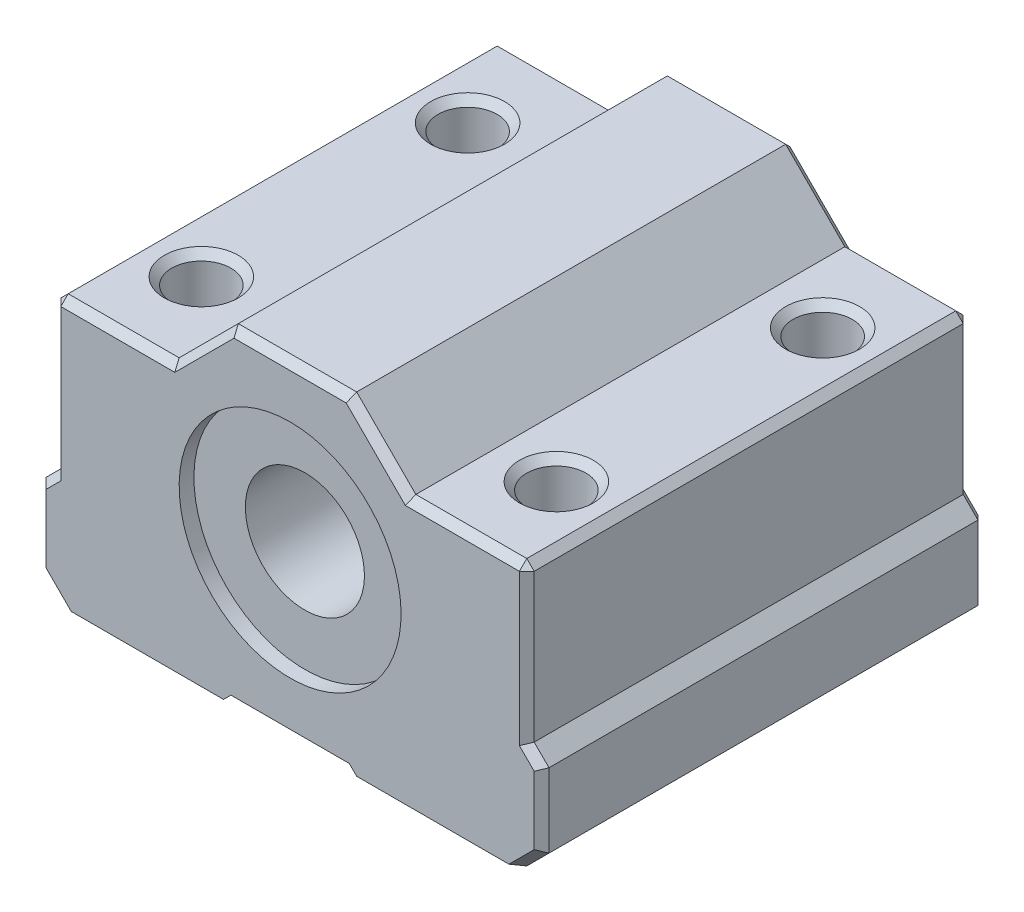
SolidWorks part; units mm, degrees
ref_plane "Ebene vorne" through (0, 0, 0) normal (0, 0, 1) x (1, 0, 0)
ref_plane "Ebene oben" through (0, 0, 0) normal (0, 1, 0) x (1, 0, 0)
ref_plane "Ebene rechts" through (0, 0, 0) normal (1, 0, 0) x (0, 0, -1)
ref_plane "Ebene1" through (0, 13.3186, 0) normal (0, 1, 0) x (1, 0, 0)
sketch "Skizze1" plane through (0, 13.3186, 0) normal (0, 1, 0) x (1, 0, 0)
  line L0 (17.0936, 0) -> (-16.9064, 0)
  line L1 (-16.9064, 0) -> (-16.9064, -30)
  line L2 (-16.9064, -30) -> (17.0936, -30)
  line L3 (17.0936, -30) -> (17.0936, 0)
extrude "Aufsatz-Linear austragen1" add sketch "Skizze1" against normal blind 22
sketch "Skizze2" plane through (0, 0, 0) normal (0, 0, -1) x (-1, 0, 0)
  line L0 (-17.0936, -1.1814) -> (-16.0936, -1.1814)
  line L1 (-16.0936, -1.1814) -> (-16.0936, 13.3186)
  line L2 (-16.0936, 13.3186) -> (-17.0936, 13.3186)
  line L3 (-17.0936, 13.3186) -> (-17.0936, -1.1814)
extrude "Schnitt-Linear austragen1" cut sketch "Skizze2" against normal through all
sketch "Skizze3" plane through (0, 0, 0) normal (0, 0, -1) x (-1, 0, 0)
  line L0 (-4.0936, 9.3186) -> (-4.0936, 13.3186)
  line L1 (-4.0936, 13.3186) -> (-16.0936, 13.3186)
  line L2 (-16.0936, 13.3186) -> (-16.0936, 9.3186)
  line L3 (-16.0936, 9.3186) -> (-4.0936, 9.3186)
extrude "Schnitt-Linear austragen2" cut sketch "Skizze3" against normal through all
sketch "Skizze4" plane through (0, 0, 0) normal (0, 0, -1) x (-1, 0, 0)
  line L0 (3.9064, 9.3186) -> (16.9064, 9.3186)
  line L1 (16.9064, 9.3186) -> (16.9064, 13.3186)
  line L2 (16.9064, 13.3186) -> (3.9064, 13.3186)
  line L3 (3.9064, 13.3186) -> (3.9064, 9.3186)
extrude "Schnitt-Linear austragen3" cut sketch "Skizze4" against normal through all
sketch "Skizze5" plane through (0, 0, 0) normal (0, 0, -1) x (-1, 0, 0)
  line L0 (15.9064, -1.1814) -> (16.9064, -1.1814)
  line L1 (16.9064, -1.1814) -> (16.9064, 9.3186)
  line L2 (16.9064, 9.3186) -> (15.9064, 9.3186)
  line L3 (15.9064, 9.3186) -> (15.9064, -1.1814)
extrude "Schnitt-Linear austragen4" cut sketch "Skizze5" against normal through all
sketch "Skizze6" plane through (0, 0, 0) normal (0, 0, -1) x (-1, 0, 0)
  line L0 (3.9064, -8.6814) -> (3.9064, -8.1814)
  line L1 (3.9064, -8.1814) -> (-4.0936, -8.1814)
  line L2 (-4.0936, -8.1814) -> (-4.0936, -8.6814)
  line L3 (-4.0936, -8.6814) -> (3.9064, -8.6814)
extrude "Schnitt-Linear austragen5" cut sketch "Skizze6" against normal through all
draft "Formschräge1" type of draft neutral plane draft angle 45 faces to draft 1 parameters "D1"=45
draft "Formschräge2" type of draft neutral plane draft angle 45 faces to draft 1 parameters "D1"=45
draft "Formschräge3" type of draft neutral plane draft angle 45 faces to draft 2 parameters "D1"=45
draft "Formschräge4" type of draft neutral plane draft angle 45 faces to draft 2 parameters "D1"=45
ref_plane "Ebene2" through (0, 2.3186, 0) normal (0, -1, 0) x (1, 0, 0)
sketch "Skizze7" plane through (0, 2.3186, 0) normal (0, -1, 0) x (1, 0, 0)
  line L0 (7.5936, 30) -> (0.0936, 30)
  line L1 (0.0936, 30) -> (0.0936, 0)
  line L2 (0.0936, 0) -> (7.5936, 0)
  line L3 (7.5936, 0) -> (7.5936, 1)
  line L4 (7.5936, 1) -> (4.1186, 1)
  line L5 (4.1186, 1) -> (4.1186, 29)
  line L6 (4.1186, 29) -> (7.5936, 29)
  line L7 (7.5936, 29) -> (7.5936, 30)
  line L8 (0.0936, 30) -> (0.0936, 0) construction
revolve "Schnitt-Rotation1" cut sketch "Skizze7" angle 360 about L8
hole_wizard "Ø4.0 (4) Durchmesser Bohrung1" positions "Skizze9" profile "Skizze8" hole size "Ø4.0" standard "ANSI Metrisch"
sketch "Skizze9" plane through (0, -8.6814, 0) normal (0, -1, 0) x (-1, 0, 0)
  point P0 (11.9064, -6)
  point P1 (11.9064, -24)
  point P2 (-12.0936, -6)
  point P3 (-12.0936, -24)
sketch "Skizze8" plane through (-11.9064, -8.6814, 6) normal (1, 0, 0) x (0, 0, -1)
  line L0 (0, 0) -> (0, 22)
  line L1 (0, 22) -> (2, 22)
  line L2 (2, 22) -> (2, 0)
  line L5 (2, 0) -> (0, 0)
  line L11 (0, -6.35) -> (0, 107.95) construction
  dimension "Bohrerdurchmesser" = 4
  dimension "Bohrungstiefe" = 22
chamfer "Fase1" distance 1.5 angle 45 2 edges at (17.0936, -8.6814, 15) (-16.9064, -8.6814, 15)
chamfer "Fase2" distance 0.5 angle 45 36 edges at (-16.1564, -7.9314, 30) (-16.9064, -4.6814, 30) (-16.4064, -1.6814, 30) (-15.9064, 4.0686, 30) (16.3436, -7.9314, 30) (17.0936, -4.6814, 30) (16.5936, -1.6814, 30) (16.0936, 4.0686, 30) (12.0936, 9.3186, 30) (6.0936, 11.3186, 30) (0.0936, 13.3186, 30) (-5.9064, 11.3186, 30) (-11.9064, 9.3186, 30) (-16.1564, -7.9314, 0) (-16.9064, -4.6814, 0) (-16.4064, -1.6814, 0) (-15.9064, 4.0686, 0) (16.3436, -7.9314, 0) (17.0936, -4.6814, 0) (16.5936, -1.6814, 0) (16.0936, 4.0686, 0) (-15.9064, 9.3186, 15) (16.0936, 9.3186, 15) (-11.9064, 9.3186, 0) (-5.9064, 11.3186, 0) (0.0936, 13.3186, 0) (12.0936, 9.3186, 0) (6.0936, 11.3186, 0) (-9.9064, 9.3186, 6) (-9.9064, 9.3186, 24) (14.0936, 9.3186, 6) (-11.9064, -8.6814, 4) (-11.9064, -8.6814, 22) (12.0936, -8.6814, 4) (14.0936, 9.3186, 24) (12.0936, -8.6814, 22)
